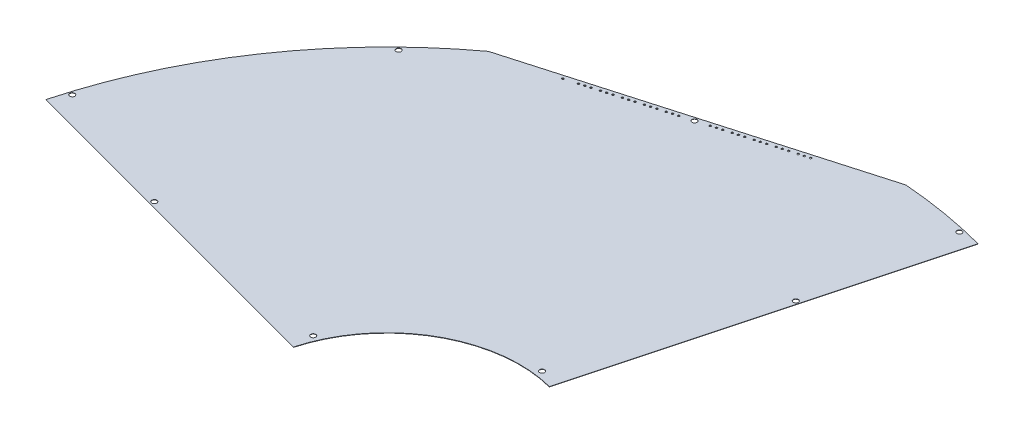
SolidWorks part; units mm, degrees
ref_plane "Front Plane" through (0, 0, 0) normal (0, 0, 1) x (1, 0, 0)
ref_plane "Top Plane" through (0, 0, 0) normal (0, 1, 0) x (1, 0, 0)
ref_plane "Right Plane" through (0, 0, 0) normal (1, 0, 0) x (0, 0, -1)
sketch "Sketch1" plane through (0, 0, 0) normal (0, 1, 0) x (1, 0, 0)
  line B0 (29.5284, 379.854) -> (-226.3334, 306.4868)
  line B1 (-101.2917, 27.6587) -> (-367.888, 99.0929)
  line B2 (26.6927, 101.5505) -> (98.127, 368.1468)
  arc B3 (29.5284, 379.854) -> (98.127, 368.1468) centre (0, 0) cw
  arc B4 (-367.888, 99.0929) -> (-226.3334, 306.4868) centre (0, 0) cw
  arc B5 (-101.2917, 27.6587) -> (26.6927, 101.5505) centre (0, 0) cw
  circle B6 centre (-360.8012, 112.7232) radius 2
  circle B7 centre (-262.5809, 271.9104) radius 2
  circle B8 centre (-101.18, 43.1579) radius 2
  circle B9 centre (-97.5756, 340.2866) radius 2
  circle B10 centre (13.2142, 109.2034) radius 2
  circle B11 centre (82.7795, 368.8246) radius 2
  circle B12 centre (65.3116, 257.2693) radius 2
  circle B13 centre (-255.4575, 72.0731) radius 2
sketch_block_instance "Quadrant Outer Profile with Gap-1"
sketch_block "Quadrant Outer Profile with Gap" parameters "D2"=381, "D3"=105, "D1"=31, "D4"=16, "D5"=357
sketch_block_instance "Hole Pin Locations-1"
sketch_block "Hole Pin Locations" parameters "D1"=4, "D10"=378, "D11"=110, "D2"=31, "D3"=3.5, "D4"=15.5, "D5"=15.5, "D6"=15.5, "D7"=3.5, "D8"=15.5, "D9"=354, "D12"=59, "D13"=265.43, "D14"=265.43, "D15"=16
extrude "Extrude1" add sketch "Sketch1" along normal blind 0.29
sketch "Sketch2" plane through (0, 0.29, 0) normal (0, 1, 0) x (1, 0, 0)
  line L0 (29.5284, 379.854) -> (-226.3334, 306.4868) construction
  circle B0 centre (-87.963, 343.043) radius 0.75
  circle B1 centre (-74.5053, 346.9019) radius 0.75
  circle B2 centre (-70.6603, 348.0045) radius 0.75
  circle B3 centre (-84.118, 344.1456) radius 0.75
  circle B4 centre (-80.2729, 345.2481) radius 0.75
  circle B5 centre (-66.8152, 349.107) radius 0.75
  circle B6 centre (-61.0477, 350.7609) radius 0.75
  circle B7 centre (-57.2026, 351.8634) radius 0.75
  circle B8 centre (-53.3576, 352.966) radius 0.75
  circle B9 centre (-47.59, 354.6198) radius 0.75
  circle B10 centre (-43.745, 355.7223) radius 0.75
  circle B11 centre (-39.8999, 356.8249) radius 0.75
  circle B12 centre (-34.1324, 358.4787) radius 0.75
  circle B13 centre (-30.2873, 359.5813) radius 0.75
  circle B14 centre (-26.4423, 360.6838) radius 0.75
  circle B15 centre (-168.709, 319.8895) radius 0.75
  circle B16 centre (-164.8639, 320.992) radius 0.75
  circle B17 centre (-161.0189, 322.0946) radius 0.75
  circle B18 centre (-155.2513, 323.7484) radius 0.75
  circle B19 centre (-151.4063, 324.8509) radius 0.75
  circle B20 centre (-147.5612, 325.9535) radius 0.75
  circle B21 centre (-141.7937, 327.6073) radius 0.75
  circle B22 centre (-137.9486, 328.7099) radius 0.75
  circle B23 centre (-134.1036, 329.8124) radius 0.75
  circle B24 centre (-128.336, 331.4662) radius 0.75
  circle B25 centre (-114.8783, 335.3252) radius 0.75
  circle B26 centre (-111.0333, 336.4277) radius 0.75
  circle B27 centre (-124.491, 332.5688) radius 0.75
  circle B28 centre (-120.6459, 333.6713) radius 0.75
  circle B29 centre (-107.1882, 337.5303) radius 0.75
  circle B30 centre (-178.3216, 317.1331) radius 0.75
sketch_block_instance "SIMM Pin Locations-1"
sketch_block "Block1" parameters "D4"=1.5, "D5"=1.5, "D1"=31, "D2"=354, "D3"=10, "D6"=84
extrude "Extrude2" cut sketch "Sketch2" against normal through all
